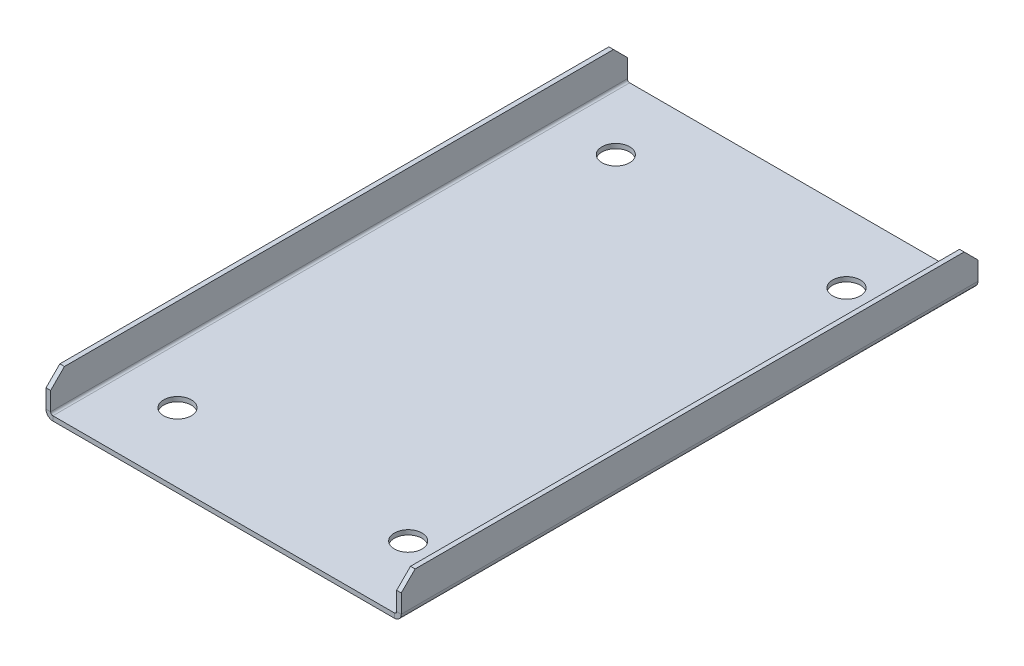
SolidWorks part; units mm, degrees
ref_plane "Plan1" through (0, 0, 0) normal (0, 0, 1) x (1, 0, 0)
ref_plane "Plan2" through (0, 0, 0) normal (0, 1, 0) x (1, 0, 0)
ref_plane "Plan3" through (0, 0, 0) normal (1, 0, 0) x (0, 0, -1)
sketch "Esquisse1" plane through (0, 0, 0) normal (0, 0, 1) x (1, 0, 0)
  line L0 (0, 15) -> (0, 0)
  line L1 (0, 0) -> (150, 0)
  line L2 (150, 0) -> (150, 15)
  dimension "D1" = 150
  dimension "D2" = 15
extrude "Base-Extru.-Mince" add sketch "Esquisse1" against normal blind 250 thin
chamfer "Chanfrein1" distance 6 angle 45
sheet metal parameters "Tôlerie 1" parameters "D1"=1
bend "Pli dans angle2" bend angle 90 parameters "D1"=0, "D5"=1
flatten bends "Dépliage 1" parameters "D1"=3
sketch "Esquisse-Angle1" plane through (0, 0, 0) normal (0, 1, 0) x (-1, 0, 0)
  line L0 (0.5708, -250) -> (0.5708, 0) construction
  line L1 (-150.5708, 0) -> (-150.5708, -250) construction
bend "Pli dans angle1" bend angle 90 parameters "D1"=0, "D5"=2
sketch "Esquisse4" plane through (0, 0, 0) normal (0, 1, 0) x (-1, 0, 0)
  circle A0 centre (-125, -220) radius 6
  circle A1 centre (-125, -30) radius 6
  circle A2 centre (-25, -220) radius 6
  circle A3 centre (-25, -30) radius 6
  dimension "D1" = 30
  dimension "D2" = 190
  dimension "D4" = 100
  dimension "D5" = 12
  dimension "D6" = 12
  dimension "D7" = 12
  dimension "D8" = 12
  dimension "D3" = 25
extrude "Enlèv. mat.-Extru.1" cut sketch "Esquisse4" against normal through all
process bends "Pliage 1" parameters "D1"=3
sketch "Esquisse-Plate1" plane through (0, 0, 0) normal (0, 1, 0) x (-1, 0, 0)
